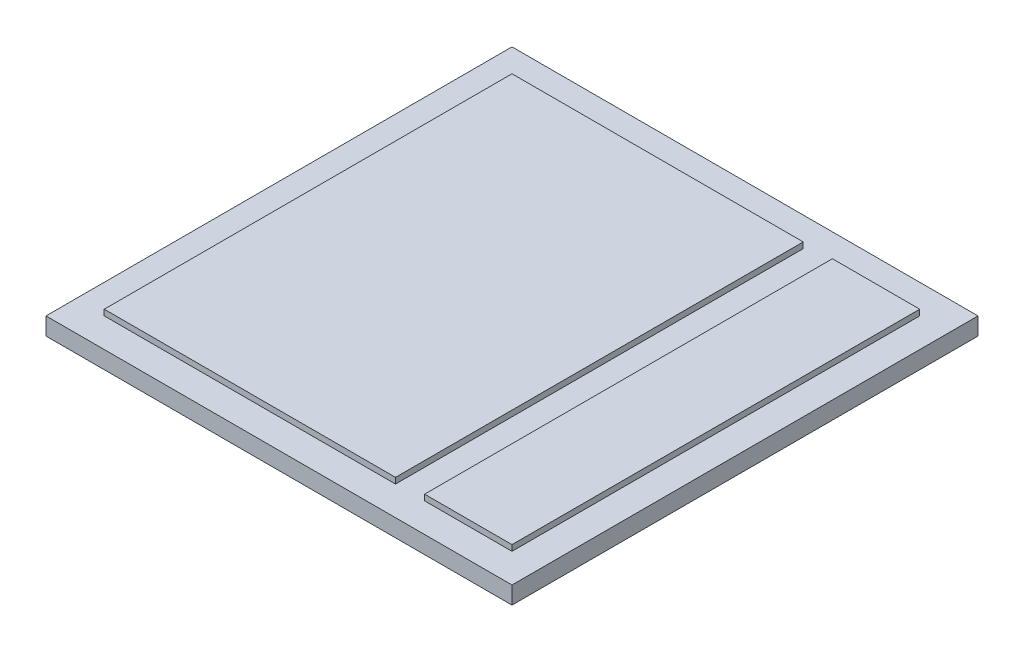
SolidWorks part; units mm, degrees
ref_plane "Piano frontale" through (0, 0, 0) normal (0, 0, 1) x (1, 0, 0)
ref_plane "Piano superiore" through (0, 0, 0) normal (0, 1, 0) x (1, 0, 0)
ref_plane "Piano destro" through (0, 0, 0) normal (1, 0, 0) x (0, 0, -1)
sketch "Schizzo1" plane through (0, 0, 0) normal (0, 1, 0) x (1, 0, 0)
  line L1 (-40, 40) -> (40, 40)
  line L2 (-40, 40) -> (-40, -40)
  line L3 (-40, -40) -> (40, -40)
  line L4 (40, 40) -> (40, -40)
  line L5 (-40, 40) -> (40, -40) construction
  line L6 (-40, -40) -> (40, 40) construction
  point P0 (0, 0)
  dimension "D1" = 80
  dimension "D2" = 80
extrude "Estrusione-Estrusione1" add sketch "Schizzo1" along normal blind 3
sketch "Schizzo2" plane through (0, 3, 0) normal (0, 1, 0) x (1, 0, 0)
  line L0 (40, 40) -> (-40, 40) construction
  line L1 (-35, 35) -> (15, 35)
  line L2 (-35, 35) -> (-35, -35)
  line L3 (-35, -35) -> (15, -35)
  line L4 (15, 35) -> (15, -35)
  line L5 (-35, 35) -> (15, -35) construction
  line L6 (-35, -35) -> (15, 35) construction
  line L7 (-40, 40) -> (-40, -40) construction
  line L8 (40, -40) -> (40, 40) construction
  line L9 (20, 35) -> (35, 35)
  line L10 (20, 35) -> (20, -35)
  line L11 (20, -35) -> (35, -35)
  line L12 (35, 35) -> (35, -35)
  line L13 (20, 35) -> (35, -35) construction
  line L14 (20, -35) -> (35, 35) construction
  line L15 (-40, -40) -> (40, -40) construction
  point P0 (-10, 0)
  point P9 (27.5, 0)
  dimension "D1" = 70
  dimension "D2" = 5
  dimension "D3" = 5
  dimension "D4" = 50
  dimension "D5" = 70
  dimension "D6" = 15
  dimension "D7" = 5
  dimension "D8" = 5
extrude "Estrusione-Estrusione2" add sketch "Schizzo2" along normal blind 1
